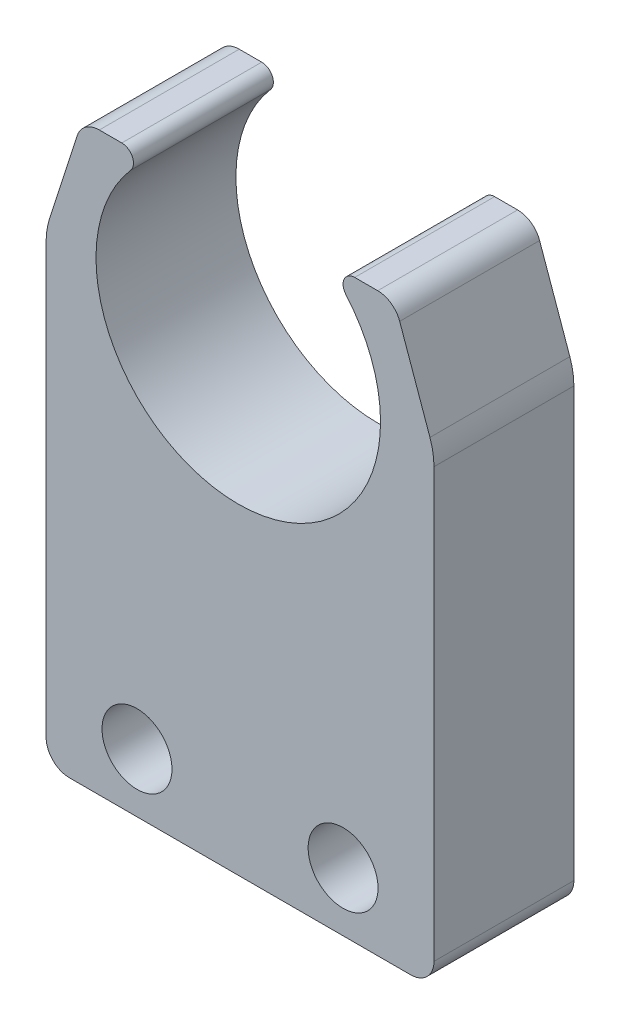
SolidWorks part; units mm, degrees
ref_plane "Front Plane" through (0, 0, 0) normal (0, 0, 1) x (1, 0, 0)
ref_plane "Top Plane" through (0, 0, 0) normal (0, 1, 0) x (1, 0, 0)
ref_plane "Right Plane" through (0, 0, 0) normal (1, 0, 0) x (0, 0, -1)
sketch "Sketch1" plane through (0, 0, 0) normal (0, 0, 1) x (1, 0, 0)
  line L0 (-233.2763, 43.0927) -> (-232.3125, 43.0927)
  line L1 (-222.3245, 43.0927) -> (-221.339, 43.0927)
  line L2 (-235.5579, 37.8057) -> (-235.5579, 19.3926)
  line L3 (-234.5579, 18.3926) -> (-219.9264, 18.3926)
  line L4 (-227.2422, 26.4355) -> (-227.2422, 17.1987) construction
  line L5 (-218.9264, 37.7619) -> (-218.9264, 19.3926)
  line L6 (-234.228, 42.3997) -> (-235.413, 38.7268)
  line L7 (-220.3965, 42.4267) -> (-219.0987, 38.7638)
  circle A0 centre (-231.6608, 20.9122) radius 1.5
  arc A1 (-231.9341, 42.2658) -> (-222.7028, 42.2658) centre (-227.3185, 38.2776) ccw
  arc A2 (-231.9341, 42.2658) -> (-232.3125, 43.0927) centre (-232.3125, 42.5927) ccw
  circle A3 centre (-222.8235, 20.9122) radius 1.5
  arc A4 (-222.7028, 42.2658) -> (-222.3245, 43.0927) centre (-222.3245, 42.5927) cw
  arc A5 (-235.5579, 37.8057) -> (-235.413, 38.7268) centre (-232.5579, 37.8057) cw
  arc A6 (-218.9264, 37.7619) -> (-219.0987, 38.7638) centre (-221.9264, 37.7619) ccw
  arc A7 (-234.228, 42.3997) -> (-233.2763, 43.0927) centre (-233.2763, 42.0927) cw
  arc A8 (-220.3965, 42.4267) -> (-221.339, 43.0927) centre (-221.339, 42.0927) ccw
  arc A9 (-218.9264, 19.3926) -> (-219.9264, 18.3926) centre (-219.9264, 19.3926) cw
  arc A10 (-234.5579, 18.3926) -> (-235.5579, 19.3926) centre (-234.5579, 19.3926) cw
  point P15 (-227.2422, 18.3926)
  point P22 (-235.5579, 38.2776)
  point P25 (-218.9264, 38.2776)
  point P32 (-218.9264, 18.3926)
  point P35 (-235.5579, 18.3926)
  dimension "D1" = 0.5
  dimension "D2" = 3
  dimension "D3" = 1
  dimension "D4" = 1
extrude "Boss-Extrude1" add sketch "Sketch1" along normal blind 6
